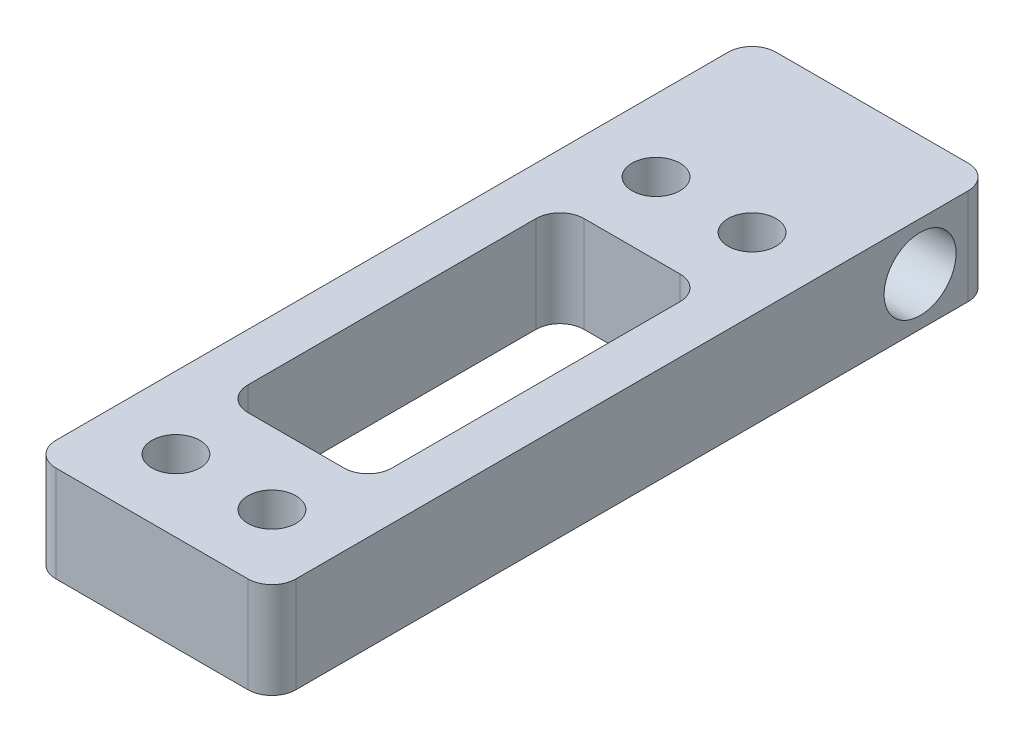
SolidWorks part; units mm, degrees
ref_plane "Front Plane" through (0, 0, 0) normal (0, 0, 1) x (1, 0, 0)
ref_plane "Top Plane" through (0, 0, 0) normal (0, 1, 0) x (1, 0, 0)
ref_plane "Right Plane" through (0, 0, 0) normal (1, 0, 0) x (0, 0, -1)
sketch "Sketch1" plane through (0, 0, 0) normal (1, 0, 0) x (0, 0, -1)
  line L1 (-85.725, -6.35) -> (9.525, -6.35)
  line L2 (-85.725, -6.35) -> (-85.725, 6.35)
  line L3 (-85.725, 6.35) -> (9.525, 6.35)
  line L4 (9.525, -6.35) -> (9.525, 6.35)
  line L5 (-85.725, -6.35) -> (9.525, 6.35) construction
  line L6 (-85.725, 6.35) -> (9.525, -6.35) construction
  circle A0 centre (0, 0) radius 4.7625
  point P3 (-38.1, 0)
  dimension "D1" = 9.525
  dimension "D2" = 12.7
  dimension "D3" = 9.525
  dimension "D4" = 95.25
extrude "Boss-Extrude1" add sketch "Sketch1" along normal blind 31.75
sketch "Sketch2" plane through (0, 6.35, 0) normal (0, 1, 0) x (1, 0, 0)
  line L0 (0, 9.525) -> (0, -85.725) construction
  line L1 (31.75, 9.525) -> (31.75, -85.725) construction
  line L2 (31.75, 9.525) -> (0, 9.525) construction
  line L3 (15.875, 9.525) -> (15.875, -85.725) construction
  line L4 (31.75, -85.725) -> (0, -85.725) construction
  line L6 (22.225, -76.2) -> (9.525, -76.2) construction
  line L7 (22.225, -76.2) -> (22.225, -12.7) construction
  line L8 (22.225, -12.7) -> (9.525, -12.7) construction
  line L9 (9.525, -76.2) -> (9.525, -12.7) construction
  line L10 (22.225, -76.2) -> (9.525, -12.7) construction
  line L11 (22.225, -12.7) -> (9.525, -76.2) construction
  line L12 (25.4, -66.675) -> (6.35, -66.675)
  line L13 (25.4, -66.675) -> (25.4, -22.225)
  line L14 (25.4, -22.225) -> (6.35, -22.225)
  line L15 (6.35, -66.675) -> (6.35, -22.225)
  line L16 (25.4, -66.675) -> (6.35, -22.225) construction
  line L17 (25.4, -22.225) -> (6.35, -66.675) construction
  circle A0 centre (9.525, -12.7) radius 3.175
  circle A1 centre (22.225, -12.7) radius 3.175
  circle A2 centre (9.525, -76.2) radius 3.175
  circle A3 centre (22.225, -76.2) radius 3.175
  point P6 (15.875, -44.45)
  point P18 (15.875, -44.45)
  dimension "D3" = 6.35
  dimension "D1" = 9.525
  dimension "D2" = 9.525
  dimension "D4" = 63.5
  dimension "D5" = 22.225
  dimension "D6" = 19.05
  dimension "D7" = 44.45
extrude "Cut-Extrude1" cut sketch "Sketch2" against normal through all
fillet "Fillet1" radius 3.175 8 edges at (0, 0, 85.725) (31.75, 0, 85.725) (0, 0, -9.525) (31.75, 0, -9.525) (6.35, 0, 66.675) (25.4, 0, 66.675) (25.4, 0, 22.225) (6.35, 0, 22.225)
